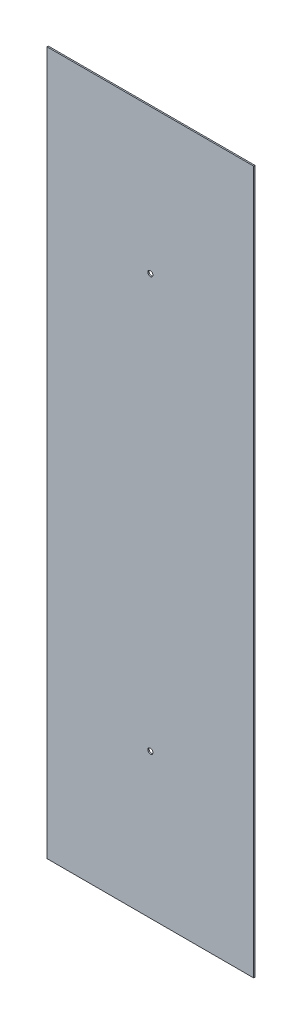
SolidWorks part; units mm, degrees
ref_plane "Front Plane" through (0, 0, 0) normal (0, 0, 1) x (1, 0, 0)
ref_plane "Top Plane" through (0, 0, 0) normal (0, 1, 0) x (1, 0, 0)
ref_plane "Right Plane" through (0, 0, 0) normal (1, 0, 0) x (0, 0, -1)
sketch "Sketch1" plane through (0, 0, 0) normal (0, 0, 1) x (1, 0, 0)
  line L0 (0, 500) -> (0, -500) construction
  line L1 (250, -850) -> (-250, -850)
  line L2 (250, -850) -> (250, 850)
  line L3 (250, 850) -> (-250, 850)
  line L4 (-250, -850) -> (-250, 850)
  line L5 (250, -850) -> (-250, 850) construction
  line L6 (250, 850) -> (-250, -850) construction
  line L7 (0, 0) -> (-31.5352, 0) construction
  circle A15 centre (0, 500) radius 6.2802
  circle A16 centre (0, -500) radius 6.2802
  point P0 (0, 0)
  point P10 (0, 0)
  point P11 (0, 0)
  point P27 (-0.226, 499.8695)
  dimension "D1" = 500
  dimension "D2" = 1700
  dimension "D3" = 1000
extrude "Boss-Extrude1" add sketch "Sketch1" along normal blind 3.175
